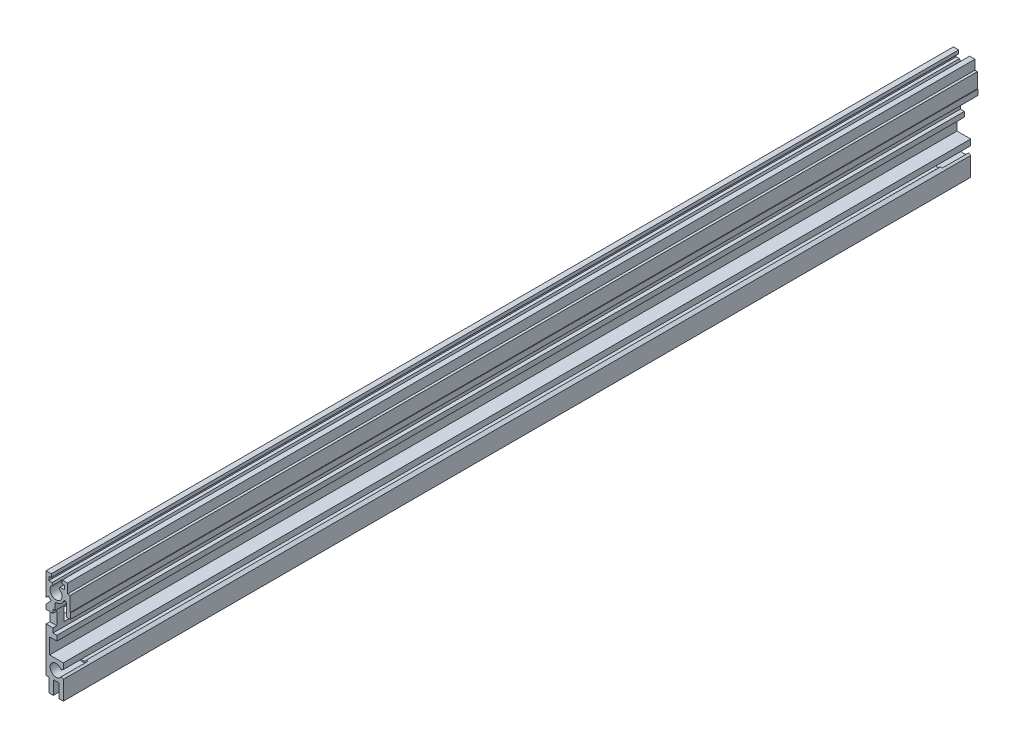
SolidWorks part; units mm, degrees
ref_plane "前视基准面" through (0, 0, 0) normal (0, 0, 1) x (1, 0, 0)
ref_plane "上视基准面" through (0, 0, 0) normal (0, 1, 0) x (1, 0, 0)
ref_plane "右视基准面" through (0, 0, 0) normal (1, 0, 0) x (0, 0, -1)
sketch "草图1" plane through (0, 0, 0) normal (0, 0, 1) x (1, 0, 0)
  line L43 (-2.5, -8.3) -> (-1, -8.3)
  line L44 (1.1, -8.3) -> (2.6, -8.3)
  line L45 (-3.6, -3.4) -> (-3.6, 18.7)
  line L46 (-3.6, 20.7928) -> (-3.6, 29.1)
  line L47 (0.3, 9.2) -> (0.3, 11)
  line L48 (-1.1, 11) -> (-1.1, 18.4)
  line L49 (-2.3, 3.6) -> (-2.3, 9.2)
  line L50 (1.1, -8.3) -> (1.1, -3.4)
  line L51 (-1, -8.3) -> (-1, -3.4)
  line L52 (-2.5, -8.3) -> (-2.5, -3.4)
  line L53 (2.2, 29.1) -> (4.1, 29.1)
  line L54 (1.4434, 26.5) -> (3.1, 26.5)
  line L55 (2.2, 27.9) -> (3.1, 27.9)
  line L56 (4.1, 25.7) -> (5, 25.7)
  line L57 (5, 20.4) -> (5.2, 20.4)
  line L58 (3.7, 18.4) -> (5.2, 18.4)
  line L59 (-1.1, 11) -> (0.3, 11)
  line L60 (-2.3, 9.2) -> (0.3, 9.2)
  line L61 (-2.3, 3.6) -> (2.6, 3.6)
  line L62 (-1, -3.4) -> (1.1, -3.4)
  line L63 (-2.5, -3.4) -> (-3.6, -3.4)
  line L64 (2.6, -8.3) -> (2.6, -1.5011)
  line L65 (5.2, 20.4) -> (5.2, 18.4)
  line L66 (5, 25.7) -> (5, 20.4)
  line L67 (-0.3, 20.5558) -> (-0.3, 18.4)
  line L68 (3.7, 22.7106) -> (3.7, 18.4)
  line L69 (1.4289, 0.825) -> (2.6, 1.5011)
  line L70 (1.4289, -0.825) -> (2.6, -1.5011)
  line L71 (2.6, 1.5011) -> (2.6, 3.6)
  line L72 (-1.1, 18.4) -> (-0.3, 18.4)
  line L73 (4.1, 25.7) -> (4.1, 29.1)
  line L74 (3.1, 26.5) -> (3.1, 27.9)
  line L75 (2.2, 27.9) -> (2.2, 29.1)
  line L76 (-0.825, 25.4289) -> (-1.4434, 26.5)
  line L77 (0.825, 25.4289) -> (1.4434, 26.5)
  line L78 (-1.4434, 26.5) -> (-2.6, 26.5)
  line L79 (-1.7, 27.9) -> (-2.6, 27.9)
  line L80 (-2.6, 26.5) -> (-2.6, 27.9)
  line L81 (-1.7, 27.9) -> (-1.7, 29.1)
  line L82 (-1.7, 29.1) -> (-3.6, 29.1)
  line L83 (-1.8, 20.7) -> (-3.6, 18.7)
  line L84 (-2.8406, 21.6366) -> (-3.6, 20.7928)
  line L85 (-1.8, 20.7) -> (-2.8406, 21.6366)
  arc A5 (-0.825, 25.4289) -> (0.825, 25.4289) centre (0, 24) ccw
  arc A6 (0.171, 21.055) -> (2.7362, 22.8975) centre (0, 24) ccw
  arc A7 (0.171, 21.055) -> (-0.3, 20.5558) centre (0.2, 20.5558) ccw
  arc A8 (3.7, 22.7106) -> (2.7362, 22.8975) centre (3.2, 22.7106) ccw
  arc A9 (1.4289, 0.825) -> (1.4289, -0.825) centre (0, 0) ccw
extrude "凸台-拉伸1" add sketch "草图1" against normal blind 325.12
sketch "草图2" plane through (-1.1, 0, 0) normal (1, 0, 0) x (0, 0, -1)
  line L0 (325.12, 29.1) -> (0, 29.1) construction
  line L1 (4.02, 17.1) -> (11.52, 17.1)
  line L2 (4.02, 17.1) -> (4.02, 12.6)
  line L3 (4.02, 12.6) -> (11.52, 12.6)
  line L4 (11.52, 17.1) -> (11.52, 12.6)
  line L5 (4.02, 17.1) -> (11.52, 12.6) construction
  line L6 (4.02, 12.6) -> (11.52, 17.1) construction
  line L7 (0, 11) -> (0, 18.4) construction
  point P0 (7.77, 14.85)
  dimension "D1" = 7.5
  dimension "D2" = 4.5
  dimension "D3" = 12
  dimension "D4" = 4.02
extrude "切除-拉伸1" cut sketch "草图2" against normal up to next
pattern_linear "阵列(线性)1" count 32 spacing 10.16 along (0, 0, -1) of "切除-拉伸1"
sketch "草图3" plane through (0, 0, 0) normal (0, 0, 1) x (1, 0, 0)
  circle A0 centre (0, 0) radius 2.15
  circle A1 centre (0, 24) radius 2.15
extrude "切除-拉伸2" cut sketch "草图3" against normal blind 9.5
sketch "草图4" plane through (0, 0, -325.12) normal (0, 0, -1) x (-1, 0, 0)
  circle A0 centre (0, 0) radius 2.15
  circle A1 centre (0, 24) radius 2.15
  dimension "D1" = 4.3
  dimension "D2" = 4.3
extrude "切除-拉伸3" cut sketch "草图4" against normal blind 9.5
sketch "草图5" plane through (-3.6, 0, 0) normal (-1, 0, 0) x (0, 0, 1)
  line L0 (0, 18.7) -> (0, -3.4) construction
  line L1 (-1.36, 17.1) -> (0, 17.1)
  line L2 (-1.36, 17.1) -> (-1.36, 12.6)
  line L3 (-1.36, 12.6) -> (0, 12.6)
  line L4 (0, 17.1) -> (0, 12.6)
  line L5 (-11.52, 17.1) -> (-4.02, 17.1) construction
  line L6 (-4.02, 12.6) -> (-11.52, 12.6) construction
  line L7 (-4.02, 17.1) -> (-4.02, 12.6) construction
  line L8 (-162.56, 29.1) -> (-162.56, -8.3) construction
  line L9 (-325.12, 29.1) -> (0, 29.1) construction
  line L10 (-325.12, -8.3) -> (0, -8.3) construction
  line L11 (-325.12, 17.1) -> (-325.12, 12.6)
  line L12 (-323.76, 12.6) -> (-325.12, 12.6)
  line L13 (-323.76, 17.1) -> (-323.76, 12.6)
  line L14 (-323.76, 17.1) -> (-325.12, 17.1)
  dimension "D1" = 2.66
extrude "切除-拉伸4" cut sketch "草图5" against normal blind 10
